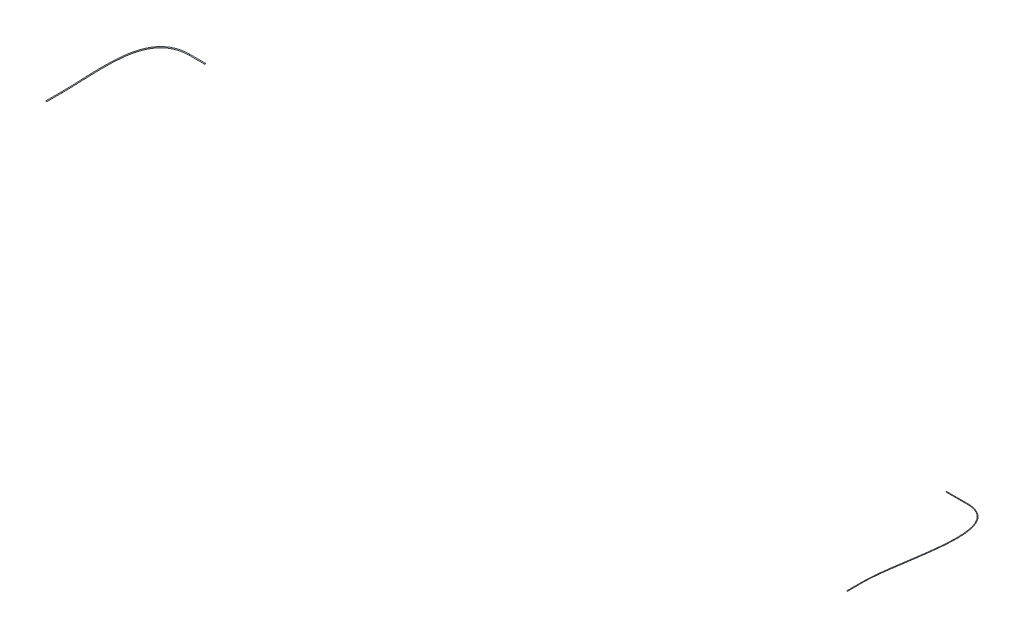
SolidWorks part; units mm, degrees
ref_plane "Front Plane" through (0, 0, 0) normal (0, 0, 1) x (1, 0, 0)
ref_plane "Top Plane" through (0, 0, 0) normal (0, 1, 0) x (1, 0, 0)
ref_plane "Right Plane" through (0, 0, 0) normal (1, 0, 0) x (0, 0, -1)
sketch3d "3DSketch1"
  line L0 (2.3158, 18.963, -11.6432) -> (-18.3003, 18.963, -11.6432) construction
  line L1 (-28.9175, 35.1192, 98.5293) -> (-28.9175, 35.1192, 85.8293) construction
  line L2 (-5.6003, 18.963, -11.6432) -> (-18.3003, 18.963, -11.6432)
  line L3 (-28.9175, 35.1192, 98.5293) -> (-28.9175, 35.1192, 85.8293)
  spline S0 degree 3 poles (-1417.2363, -590.3231, -1207.1908) (1452.3232, 645.7122, 1751.3317) (-1547.0213, -503.7554, -1657.0693) (1431.5201, 414.858, 1305.4742) knots -2.266837 -2.266837 -2.266837 -2.266837 2.898674 2.898674 2.898674 2.898674 only from (-28.9175, 35.1192, 85.8293) to (-18.3003, 18.963, -11.6432) construction
  spline S1 degree 3 poles (-28.9175, 35.1192, 85.8293) (-28.9175, 35.1192, 51.6536) (-54.0295, 18.963, -11.6432) (-18.3003, 18.963, -11.6432) knots 0 0 0 0 1 1 1 1
ref_plane "Plane1" through (-5.6003, 18.963, -11.6432) normal (-1, 0, 0) x (0, 0, 1)
sketch "PipeSketch" plane through (-5.6003, 18.963, -11.6432) normal (-1, 0, 0) x (0, 0, 1)
  circle A0 centre (0, 0) radius 0.381
  dimension "OuterDiameter" = 0.762
sweep "Cable_1" add profiles "PipeSketch" path "3DSketch1"
sketch3d "3DSketch2"
  line L0 (610.3622, 18.963, -11.6432) -> (636.027, 18.963, -11.6432) construction
  line L1 (649.7235, 19.6506, 103.2283) -> (649.7235, 19.6506, 90.5283) construction
  line L2 (618.2783, 18.963, -11.6432) -> (636.027, 18.963, -11.6432)
  line L3 (649.7235, 19.6506, 103.2283) -> (649.7235, 19.6506, 90.5283)
  spline S0 degree 3 poles (2025.4737, -7.9262, -1358.6423) (-809.5101, 46.2323, 1909.6785) (2141.9299, -3.5268, -1777.792) (-792.7939, 35.8222, 1385.3322) knots -2.297817 -2.297817 -2.297817 -2.297817 2.899094 2.899094 2.899094 2.899094 only from (649.7235, 19.6506, 90.5283) to (636.027, 18.963, -11.6432) construction
  spline S1 degree 3 poles (649.7235, 19.6506, 90.5283) (649.7235, 19.6506, 55.2026) (672.8791, 18.963, -11.6432) (636.027, 18.963, -11.6432) knots 0 0 0 0 1 1 1 1
ref_plane "Plane2" through (618.2783, 18.963, -11.6432) normal (1, 0, 0) x (0, 0, -1)
sketch "Sketch2" plane through (618.2783, 18.963, -11.6432) normal (1, 0, 0) x (0, 0, -1)
  circle A0 centre (0, 0) radius 0.25
  dimension "OuterDiameter" = 0.5
sweep "Cable_2" add profiles "Sketch2" path "3DSketch2"
